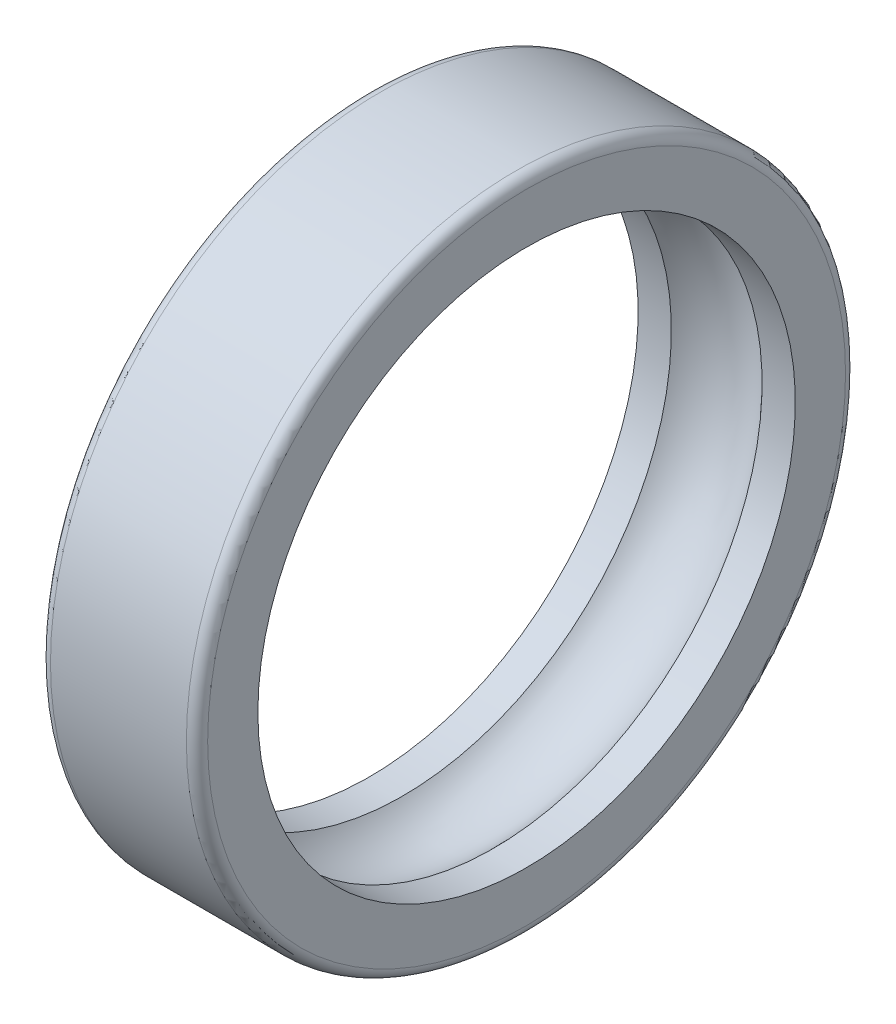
SolidWorks part; units mm, degrees
ref_plane "Front Plane" through (0, 0, 0) normal (0, 0, 1) x (1, 0, 0)
ref_plane "Top Plane" through (0, 0, 0) normal (0, 1, 0) x (1, 0, 0)
ref_plane "Right Plane" through (0, 0, 0) normal (1, 0, 0) x (0, 0, -1)
sketch "Sketch1" plane through (0, 0, 0) normal (0, 0, 1) x (1, 0, 0)
  line L0 (-9.5041, 0) -> (48.2222, 0) construction
  line L1 (0, 53) -> (0, 0) construction
  line L2 (-15.5, 53) -> (-8.9443, 53)
  line L3 (-15.5, 53) -> (-15.5, 65)
  line L4 (-15.5, 65) -> (15.5, 65)
  line L5 (15.5, 53) -> (15.5, 65)
  line L6 (-15.5, 53) -> (15.5, 65) construction
  line L7 (-15.5, 65) -> (15.5, 53) construction
  line L8 (8.9443, 53) -> (15.5, 53)
  arc A0 (8.9443, 53) -> (-8.9443, 53) centre (0, 45) ccw
  point P3 (0, 59)
  dimension "D5" = 12
  dimension "D1" = 31
  dimension "D2" = 53
  dimension "D3" = 65
  dimension "D4" = 8
revolve "Revolve2" add sketch "Sketch1" angle 360 about L0
fillet "Fillet1" radius 2.1 2 edges at (15.5, 0, 65) (-15.5, 0, 65)
